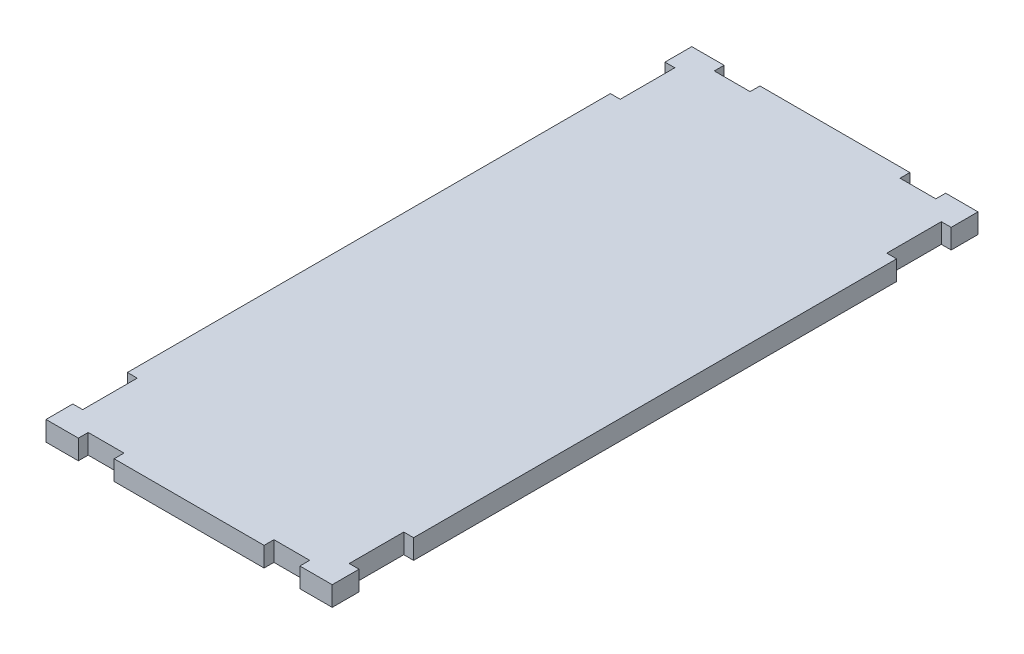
SolidWorks part; units mm, degrees
ref_plane "Alzado" through (0, 0, 0) normal (0, 0, 1) x (1, 0, 0)
ref_plane "Planta" through (0, 0, 0) normal (0, 1, 0) x (1, 0, 0)
ref_plane "Vista lateral" through (0, 0, 0) normal (1, 0, 0) x (0, 0, -1)
sketch "Croquis2" plane through (0, 0, 0) normal (0, 1, 0) x (1, 0, 0)
  line L0 (0, 140.5) -> (0, 321) construction
  line L1 (61.9143, 321) -> (61.9143, 315.5)
  line L2 (0, 0) -> (80, 0)
  line L3 (0, 140.5) -> (0, 321)
  line L4 (0, 321) -> (41.9143, 321)
  line L5 (80, 140.5) -> (80, 275.5)
  line L6 (61.9143, 315.5) -> (41.9143, 315.5)
  line L7 (41.9143, 315.5) -> (41.9143, 321)
  line L8 (61.9143, 321) -> (80, 321)
  line L9 (80, 306) -> (74.5, 306)
  line L10 (74.5, 306) -> (74.5, 275.5)
  line L11 (74.5, 275.5) -> (80, 275.5)
  line L12 (80, 306) -> (80, 321)
  line L13 (0, 140.5) -> (80, 140.5) construction
  line L14 (0, 140.5) -> (80, 140.5)
  dimension "D2" = 80
  dimension "D3" = 20
  dimension "D4" = 5.5
  dimension "D5" = 30.5
  dimension "D6" = 15
  dimension "D7" = 180.5
extrude "Saliente-Extruir1" add sketch "Croquis2" along normal blind 5.5 contours L3 L14 L5 L11 L10 L9 L12 L8 L1 L6 L7 L4
mirror "Simetría1" about plane through (0, 5.5, -140.5) normal (0, 0, -1) of "Saliente-Extruir1"
mirror "Simetría6" about plane through (0, 5.5, 0) normal (-1, 0, 0)
